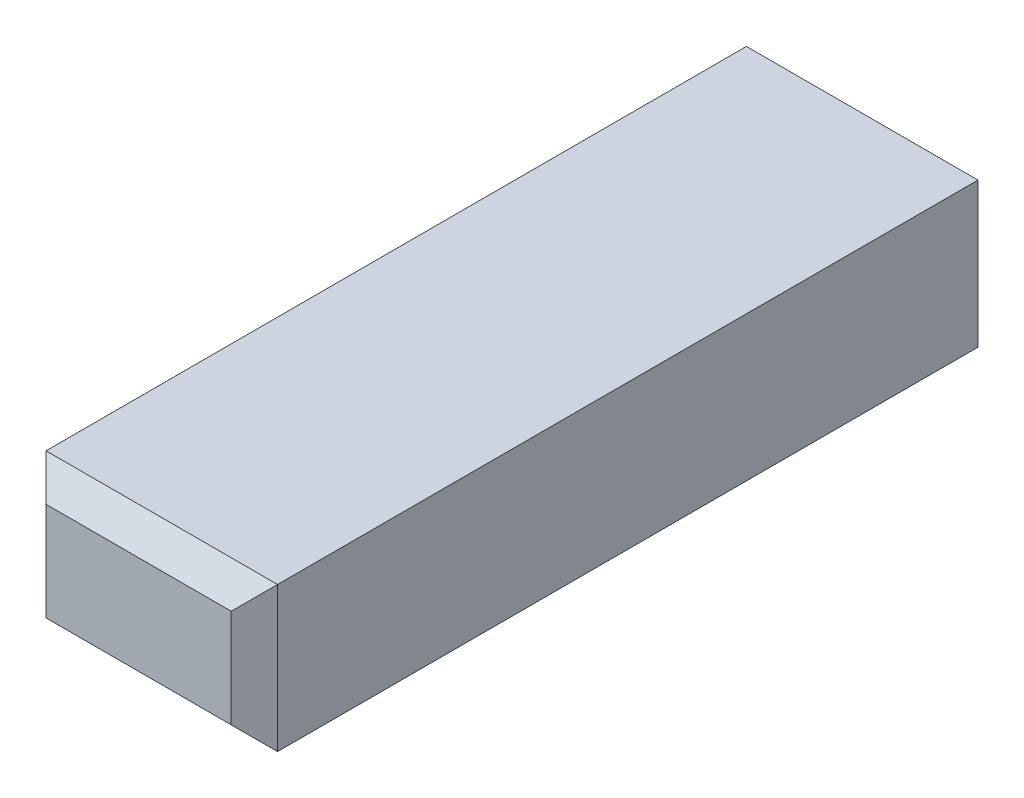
SolidWorks part; units mm, degrees
ref_plane "Front Plane" through (0, 0, 0) normal (0, 0, 1) x (1, 0, 0)
ref_plane "Top Plane" through (0, 0, 0) normal (0, 1, 0) x (1, 0, 0)
ref_plane "Right Plane" through (0, 0, 0) normal (1, 0, 0) x (0, 0, -1)
sketch "Sketch1" plane through (0, 0, 0) normal (0, 0, 1) x (1, 0, 0)
  line L1 (-8, -5) -> (8, -5)
  line L2 (-8, -5) -> (-8, 5)
  line L3 (-8, 5) -> (8, 5)
  line L4 (8, -5) -> (8, 5)
  line L5 (-8, -5) -> (8, 5) construction
  line L6 (-8, 5) -> (8, -5) construction
  point P0 (0, 0)
  dimension "D1" = 16
  dimension "D2" = 10
extrude "Boss-Extrude1" add sketch "Sketch1" along normal mid plane 50
chamfer "Chamfer1" distance 1.6 angle 45 4 edges at (0, -5, 25) (-8, 0, 25) (0, 5, 25) (8, 0, 25)
